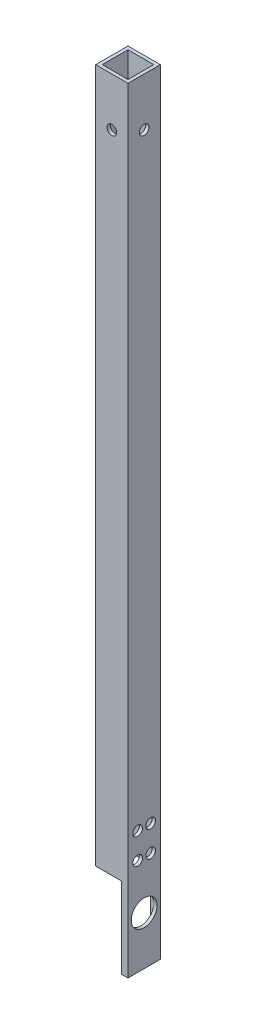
SolidWorks part; units mm, degrees
ref_plane "Front" through (0, 0, 0) normal (0, 0, 1) x (1, 0, 0)
ref_plane "Top" through (0, 0, 0) normal (0, 1, 0) x (1, 0, 0)
ref_plane "Right" through (0, 0, 0) normal (1, 0, 0) x (0, 0, -1)
sketch "草图1" plane through (0, 0, 0) normal (0, 1, 0) x (1, 0, 0)
  line L1 (-5, -5) -> (5, -5)
  line L2 (-5, -5) -> (-5, 5)
  line L3 (-5, 5) -> (5, 5)
  line L4 (5, -5) -> (5, 5)
  line L5 (-5, -5) -> (5, 5) construction
  line L6 (-5, 5) -> (5, -5) construction
  line L7 (-4, -4) -> (4, -4)
  line L8 (-4, -4) -> (-4, 4)
  line L9 (-4, 4) -> (4, 4)
  line L10 (4, -4) -> (4, 4)
  line L11 (-4, -4) -> (4, 4) construction
  line L12 (-4, 4) -> (4, -4) construction
  point P1 (0, 0)
  point P6 (0, 0)
  dimension "D1" = 10
  dimension "D2" = 10
  dimension "D3" = 1
extrude "凸台-拉伸1" add sketch "草图1" along normal blind 240
sketch "草图2" plane through (0, 0, 5) normal (0, 0, 1) x (1, 0, 0)
  line L0 (-5, 240) -> (5, 240) construction
  line L1 (5, 240) -> (5, 0) construction
  circle A0 centre (0, 225) radius 1.5
  dimension "D1" = 15
  dimension "D3" = 3
  dimension "D2" = 5
extrude "切除-拉伸1" cut sketch "草图2" against normal up to surface (10 mm away)
sketch "草图3" plane through (5, 0, 0) normal (1, 0, 0) x (0, 0, -1)
  line L0 (-5, 240) -> (5, 240) construction
  line L2 (5, 240) -> (5, 0) construction
  circle A0 centre (0, 225) radius 1.5
  dimension "D1" = 15
  dimension "D2" = 3
  dimension "D3" = 5
extrude "切除-拉伸2" cut sketch "草图3" against normal up to surface (10 mm away)
sketch "草图4" plane through (0, 0, 5) normal (0, 0, 1) x (1, 0, 0)
  line L0 (-5, 240) -> (-5, 0) construction
  line L1 (-5, 0) -> (5, 0) construction
  circle A0 centre (0, 8) radius 1.5
  dimension "D1" = 5
  dimension "D2" = 8
  dimension "D3" = 3
extrude "切除-拉伸3" cut sketch "草图4" against normal up to surface (10 mm away)
sketch "草图5" plane through (-5, 0, 0) normal (-1, 0, 0) x (0, 0, 1)
  line L0 (5, 240) -> (5, 0) construction
  line L1 (-5, 0) -> (5, 0) construction
  circle A0 centre (0, 15) radius 3
  dimension "D1" = 5
  dimension "D2" = 15
  dimension "D3" = 6
extrude "切除-拉伸4" cut sketch "草图5" against normal up to surface (10 mm away)
sketch "草图6" plane through (5, 0, 0) normal (1, 0, 0) x (0, 0, -1)
  line L0 (5, 240) -> (5, 0) construction
  line L1 (-5, 0) -> (5, 0) construction
  circle A0 centre (2, 30) radius 1.5
  circle A1 centre (-2, 30) radius 1.5
  circle A2 centre (2, 38) radius 1.5
  circle A3 centre (-2, 38) radius 1.5
  dimension "D1" = 8
  dimension "D5" = 3
  dimension "D6" = 3
  dimension "D7" = 3
  dimension "D8" = 3
  dimension "D2" = 8
  dimension "D3" = 4
  dimension "D4" = 3
  dimension "D9" = 30
extrude "切除-拉伸5" cut sketch "草图6" against normal up to surface (10 mm away)
sketch "草图7" plane through (5, 0, 0) normal (1, 0, 0) x (0, 0, -1)
  circle A0 centre (0, 15) radius 4
  dimension "D1" = 8
extrude "切除-拉伸6" cut sketch "草图7" against normal up to surface (1 mm away)
sketch "草图8" plane through (-5, 0, 0) normal (-1, 0, 0) x (0, 0, 1)
  line L0 (-5, 240) -> (-5, 0) construction
  line L1 (-5, 25) -> (5, 25)
  line L2 (-5, 25) -> (-5, 0)
  line L3 (-5, 0) -> (5, 0)
  line L4 (5, 25) -> (5, 0)
  circle A0 centre (0, 15) radius 3 construction
  dimension "D1" = 10
extrude "切除-拉伸7" cut sketch "草图8" against normal blind 8
